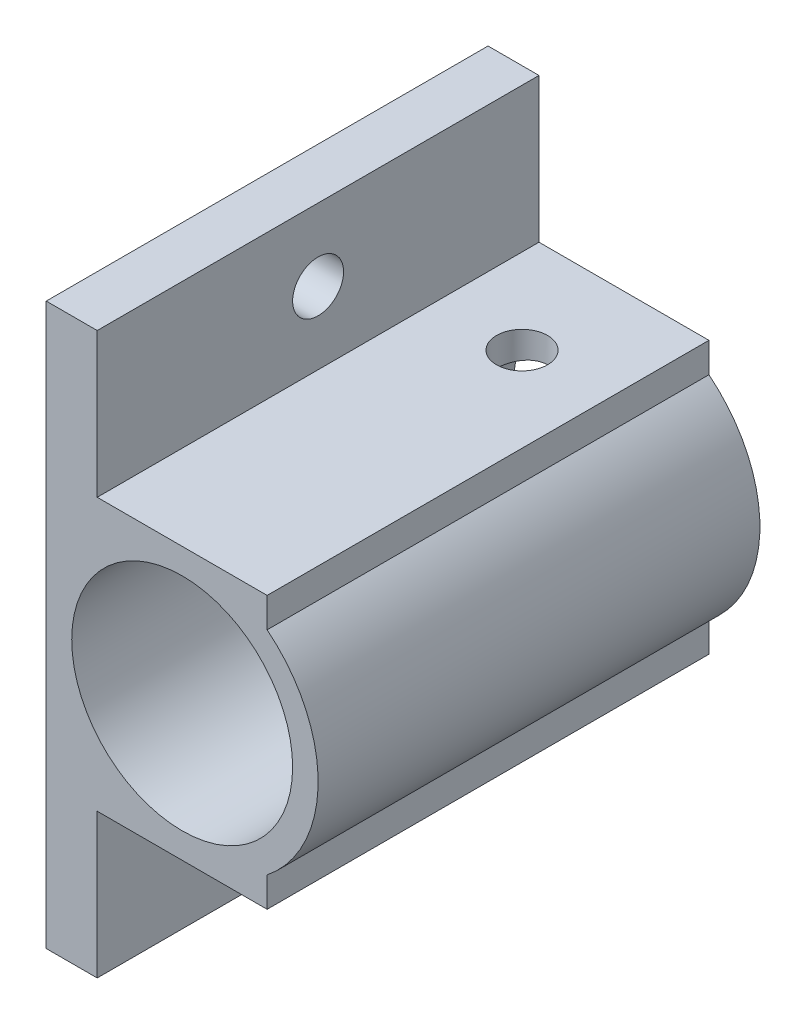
SolidWorks part; units mm, degrees
ref_plane "Front Plane" through (0, 0, 0) normal (0, 0, 1) x (1, 0, 0)
ref_plane "Top Plane" through (0, 0, 0) normal (0, 1, 0) x (1, 0, 0)
ref_plane "Right Plane" through (0, 0, 0) normal (1, 0, 0) x (0, 0, -1)
sketch "Sketch1" plane through (0, 0, 0) normal (0, 0, 1) x (1, 0, 0)
  line L0 (-5, 0) -> (-5, 16.5)
  line L9 (-5, 0) -> (-5, -16.5)
  line L11 (-5, 16.5) -> (-8, 16.5)
  line L12 (-5, 16.5) -> (-5, -16.5)
  line L13 (-5, -16.5) -> (-8, -16.5)
  line L14 (-8, 16.5) -> (-8, -16.5)
  line L15 (-5, 8) -> (5, 8)
  line L16 (-5, 8) -> (-5, -8)
  line L17 (-5, -8) -> (5, -8)
  line L18 (5, 8) -> (5, -8)
  line L19 (-5, 8) -> (5, -8) construction
  line L20 (-5, -8) -> (5, 8) construction
  circle A0 centre (0, 0) radius 6.5
  circle A1 centre (0, 0) radius 8
  dimension "D1" = 10
  dimension "D2" = 16
  dimension "D3" = 3
extrude "Boss-Extrude1" add sketch "Sketch1" along normal blind 26 contours A1 L0 L12 L11 L14 | A1 L14 L13 L12 L9 | L16 A1 A0 | L18 A1 L16 A0 | L18 A1 A0 | L16 A1 L18 A0 | A1 L9 L17 | A1 L17 L18 | A1 L18 L15 | A1 L15 L0
sketch "Sketch7" plane through (0, 8, 0) normal (0, 1, 0) x (1, 0, 0)
  line L0 (-5, 0) -> (5, 0) construction
  circle A0 centre (0, -6) radius 1.5
  dimension "D1" = 6
extrude "Cut-Extrude3" cut sketch "Sketch7" against normal blind 4
sketch "Sketch8" plane through (-5, 0, 0) normal (1, 0, 0) x (0, 0, -1)
  circle A0 centre (-13, 12.25) radius 1.5
  circle A1 centre (-13, -12.25) radius 1.5
extrude "Cut-Extrude4" cut sketch "Sketch8" against normal blind 4
